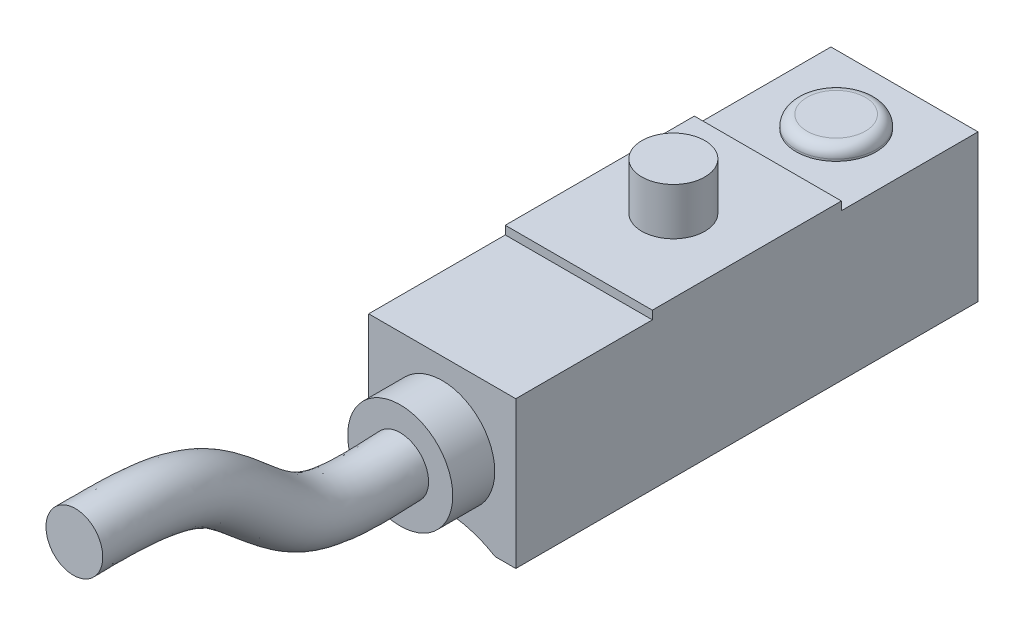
SolidWorks part; units mm, degrees
other "<21901082>-<Fillet2>"
other "<21901082>-<Web feature 1>"
ref_plane "Front" through (0, 0, 0) normal (0, 0, 1) x (1, 0, 0)
ref_plane "Top" through (0, 0, 0) normal (0, 1, 0) x (1, 0, 0)
ref_plane "Right" through (0, 0, 0) normal (1, 0, 0) x (0, 0, -1)
inserted part "21901082"
ref_plane "Plane1" [suppressed] through (0, 1.3462, 0) normal (0, 1, 0) x (-1, 0, 0)
sketch "Sketch1" [suppressed] plane through (0, 1.3462, 0) normal (0, 1, 0) x (-1, 0, 0)
  line L0 (2.5, 24) -> (-2.5, 24) construction
  line L1 (50.8, 36.7) -> (-50.8, 36.7)
  line L2 (50.8, 36.7) -> (50.8, 62.1)
  line L3 (50.8, 62.1) -> (-50.8, 62.1)
  line L4 (-50.8, 36.7) -> (-50.8, 62.1)
  dimension "D1" = 101.6
  dimension "D2" = 25.4
  dimension "D3" = 50.8
  dimension "D4" = 12.7
extrude "Extrude1" [suppressed] add sketch "Sketch1" along normal blind 0.127
sketch "Sketch2" plane through (0, 3.6, 0) normal (0, 1, 0) x (1, 0, 0)
  circle A0 centre (0, -11) radius 1.5 construction
  circle A1 centre (0, -11) radius 1.5
extrude "Boss-Extrude2" add sketch "Sketch2" along normal blind 2.54
